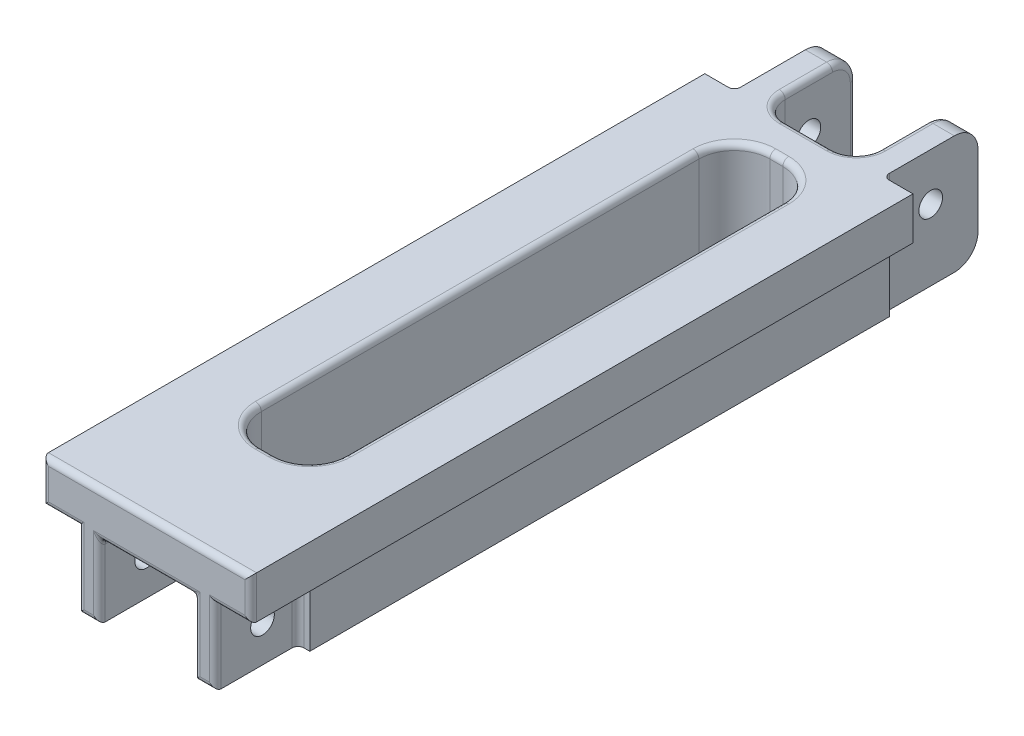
SolidWorks part; units mm, degrees
ref_plane "Front Plane" through (0, 0, 0) normal (0, 0, 1) x (1, 0, 0)
ref_plane "Top Plane" through (0, 0, 0) normal (0, 1, 0) x (1, 0, 0)
ref_plane "Right Plane" through (0, 0, 0) normal (1, 0, 0) x (0, 0, -1)
sketch "Sketch1" plane through (0, 0, 0) normal (0, 0, 1) x (1, 0, 0)
  line L0 (65.5518, -105.918) -> (177.3118, -105.918)
  line L1 (177.3118, -105.918) -> (177.3118, -128.778)
  line L2 (177.3118, -128.778) -> (164.6118, -128.778)
  line L3 (164.6118, -128.778) -> (164.6118, -156.718)
  line L4 (164.6118, -156.718) -> (205.2518, -156.718)
  line L5 (205.2518, -156.718) -> (205.2518, 1.27)
  line L6 (205.2518, 1.27) -> (-323.7269, 1.27)
  line L7 (-323.7269, 1.27) -> (-323.7269, -156.718)
  line L8 (-323.7269, -156.718) -> (-283.0869, -156.718)
  line L9 (-283.0869, -156.718) -> (-283.0869, -128.778)
  line L10 (-283.0869, -128.778) -> (-295.7869, -128.778)
  line L11 (-295.7869, -128.778) -> (-295.7869, -105.918)
  line L12 (-295.7869, -105.918) -> (-184.0269, -105.918)
  line L13 (-184.0269, -105.918) -> (-184.0269, -128.778)
  line L14 (-184.0269, -128.778) -> (-196.7269, -128.778)
  line L15 (-196.7269, -128.778) -> (-196.7269, -156.718)
  line L16 (-196.7269, -156.718) -> (-146.8676, -156.718)
  line L17 (-146.8676, -156.718) -> (-146.8676, -128.778)
  line L18 (-146.8676, -128.778) -> (-159.5676, -128.778)
  line L19 (-159.5676, -128.778) -> (-159.5676, -105.918)
  line L20 (-159.5676, -105.918) -> (41.0924, -105.918)
  line L21 (41.0924, -105.918) -> (41.0924, -128.778)
  line L22 (41.0924, -128.778) -> (28.3924, -128.778)
  line L23 (28.3924, -128.778) -> (28.3924, -156.718)
  line L24 (28.3924, -156.718) -> (78.2518, -156.718)
  line L25 (78.2518, -156.718) -> (78.2518, -128.778)
  line L26 (78.2518, -128.778) -> (65.5518, -128.778)
  line L27 (65.5518, -128.778) -> (65.5518, -105.918)
  line L29 (78.2518, -156.718) -> (164.6118, -156.718) construction
  line L30 (78.2518, -156.718) -> (78.2518, -169.418)
  line L31 (78.2518, -169.418) -> (164.6118, -169.418)
  line L32 (164.6118, -156.718) -> (164.6118, -169.418)
  line L33 (78.2518, -156.718) -> (164.6118, -169.418) construction
  line L34 (78.2518, -169.418) -> (164.6118, -156.718) construction
  line L56 (165.8818, -130.048) -> (165.8818, -155.448)
  line L57 (165.8818, -155.448) -> (203.9818, -155.448)
  line L58 (203.9818, -155.448) -> (203.9818, 0)
  line L59 (203.9818, 0) -> (-322.4569, 0)
  line L60 (-322.4569, 0) -> (-322.4569, -155.448)
  line L61 (-322.4569, -155.448) -> (-284.3569, -155.448)
  line L62 (-284.3569, -155.448) -> (-284.3569, -130.048)
  line L63 (-284.3569, -130.048) -> (-297.0569, -130.048)
  line L64 (-297.0569, -130.048) -> (-297.0569, -104.648)
  line L65 (-297.0569, -104.648) -> (-182.7569, -104.648)
  line L66 (-182.7569, -104.648) -> (-182.7569, -130.048)
  line L67 (-182.7569, -130.048) -> (-195.4569, -130.048)
  line L68 (-195.4569, -130.048) -> (-195.4569, -155.448)
  line L69 (-195.4569, -155.448) -> (-148.1376, -155.448)
  line L70 (-148.1376, -155.448) -> (-148.1376, -130.048)
  line L71 (-148.1376, -130.048) -> (-160.8376, -130.048)
  line L72 (-160.8376, -130.048) -> (-160.8376, -104.648)
  line L73 (-160.8376, -104.648) -> (42.3624, -104.648)
  line L74 (42.3624, -104.648) -> (42.3624, -130.048)
  line L75 (42.3624, -130.048) -> (29.6624, -130.048)
  line L76 (29.6624, -130.048) -> (29.6624, -155.448)
  line L77 (29.6624, -155.448) -> (76.9818, -155.448)
  line L78 (76.9818, -155.448) -> (76.9818, -130.048)
  line L79 (76.9818, -130.048) -> (64.2818, -130.048)
  line L80 (64.2818, -130.048) -> (64.2818, -104.648)
  line L81 (64.2818, -104.648) -> (178.5818, -104.648)
  line L82 (178.5818, -104.648) -> (178.5818, -130.048)
  line L83 (178.5818, -130.048) -> (165.8818, -130.048)
  line L84 (164.6118, -156.718) -> (78.2518, -156.718)
  point P58 (121.4318, -163.068)
  dimension "D1" = 28.3924
  dimension "D2" = 29.6624
  dimension "D3" = 41.0924
  dimension "D4" = 64.2818
  dimension "D5" = 65.5518
  dimension "D6" = 121.4318
  dimension "D7" = 165.8818
  dimension "D8" = 203.9818
  dimension "D9" = 205.2518
  dimension "D10" = 146.8676
  dimension "D11" = 148.1376
  dimension "D12" = 1.27
  dimension "D13" = 104.648
  dimension "D14" = 105.918
  dimension "D15" = 128.778
  dimension "D16" = 130.048
  dimension "D17" = 156.718
extrude "Boss-Extrude1" add sketch "Sketch1" against normal blind 406.4 contours L84 L3 L2 L1 L0 L27 L26 L25 | L32 L84 L30 L31
sketch "Sketch2" plane through (0, 0, -406.4) normal (0, 0, -1) x (-1, 0, 0)
  line L0 (-121.4318, -105.918) -> (-121.4318, -156.718)
  line L3 (-161.4368, -169.418) -> (-161.4368, -105.918)
  line L5 (-146.8318, -169.418) -> (-146.8318, -105.918)
  line L6 (-146.8318, -105.918) -> (-96.0318, -105.918)
  line L7 (-96.0318, -169.418) -> (-96.0318, -105.918)
  line L8 (-146.8318, -156.718) -> (-96.0318, -105.918) construction
  line L9 (-146.8318, -105.918) -> (-96.0318, -156.718) construction
  line L11 (-81.4268, -169.418) -> (-81.4268, -105.918)
  line L12 (-65.5518, -128.778) -> (-65.5518, -105.918) construction
  line L13 (-65.5518, -105.918) -> (-177.3118, -105.918) construction
  line L28 (-78.2518, -169.418) -> (-78.2518, -128.778)
  line L29 (-78.2518, -128.778) -> (-65.5518, -128.778)
  line L30 (-65.5518, -128.778) -> (-65.5518, -105.918)
  line L31 (-65.5518, -105.918) -> (-177.3118, -105.918)
  line L32 (-177.3118, -105.918) -> (-177.3118, -128.778)
  line L33 (-177.3118, -128.778) -> (-164.6118, -128.778)
  line L34 (-164.6118, -128.778) -> (-164.6118, -169.418)
  line L36 (-164.6118, -169.418) -> (-78.2518, -169.418)
  point P6 (-121.4318, -131.318)
  dimension "D1" = 12.7
  dimension "D2" = 15.875
  dimension "D3" = 30.48
  dimension "D4" = 55.88
  dimension "D5" = 95.885
  dimension "D6" = 22.86
  dimension "D7" = 63.5
extrude "Cut-Extrude1" cut sketch "Sketch2" against normal blind 50.8
sketch "Sketch3" plane through (81.4268, 0, 0) normal (-1, 0, 0) x (0, 0, 1)
  line L0 (-406.4, -169.418) -> (-406.4, -105.918) construction
  line L1 (-355.6, -105.918) -> (-406.4, -105.918) construction
  circle A0 centre (-381, -131.318) radius 6.35
  point P6 (0, 0)
  dimension "D1" = 12.7
  dimension "D2" = 25.4
  dimension "D3" = 25.4
extrude "Cut-Extrude2" cut sketch "Sketch3" against normal blind 215.9
ref_plane "Plane1" through (121.4318, 0, 0) normal (1, 0, 0) x (0, 0, -1)
sketch "Sketch4" plane through (121.4318, 0, 0) normal (1, 0, 0) x (0, 0, -1)
  line L3 (0, -105.918) -> (0, -128.778) construction
  line L4 (355.6, -105.918) -> (0, -105.918) construction
  line L6 (44.45, -149.098) -> (44.45, -168.148)
  line L7 (44.45, -168.148) -> (25.4, -168.148)
  line L9 (25.4, -130.048) -> (-7.9413, -130.048)
  line L10 (25.4, -130.048) -> (25.4, -168.148)
  line L11 (25.4, -168.148) -> (-7.9413, -168.148)
  line L12 (-7.9413, -130.048) -> (-7.9413, -168.148)
  line L13 (25.4, -130.048) -> (-7.9413, -168.148) construction
  line L14 (25.4, -168.148) -> (-7.9413, -130.048) construction
  line L15 (-7.9413, -168.148) -> (44.45, -168.148)
  line L16 (-7.9413, -168.148) -> (-7.9413, -197.6525)
  line L17 (-7.9413, -197.6525) -> (44.45, -197.6525)
  line L18 (44.45, -168.148) -> (44.45, -197.6525)
  line L19 (-7.9413, -168.148) -> (44.45, -197.6525) construction
  line L20 (-7.9413, -197.6525) -> (44.45, -168.148) construction
  circle A0 centre (25.4, -149.098) radius 6.35
  circle A3 centre (25.4, -149.098) radius 19.05
  point P13 (8.7294, -149.098)
  point P16 (18.2544, -182.9002)
  dimension "D1" = 12.7
  dimension "D2" = 38.1
  dimension "D3" = 25.4
  dimension "D4" = 43.18
extrude "Cut-Extrude3" cut sketch "Sketch4" against normal mid plane 50.8 contours A3 L7 L6 | A3 L10 A0 | L10 A3 A0 | A3 L9 L12 L11 | L10 A0 | L10 A0 | L18 L7 L11 L16 L17
sketch "Sketch5" plane through (0, -169.418, -39.0066) normal (0, 1, 0) x (1, 0, 0)
  line L1 (158.2618, -39.0066) -> (84.6018, -39.0066)
  line L2 (158.2618, -39.0066) -> (158.2618, 79.3855)
  line L3 (164.6118, 5.4434) -> (78.2518, 5.4434)
  line L4 (84.6018, -39.0066) -> (84.6018, 79.3855)
  line L5 (158.2618, -39.0066) -> (84.6018, 79.3855) construction
  line L6 (158.2618, 79.3855) -> (84.6018, -39.0066) construction
  line L10 (96.0318, 5.4434) -> (146.8318, 5.4434)
  line L18 (571.0118, 451.8725) -> (-648.1882, 451.8725)
  line L19 (571.0118, 308.1896) -> (571.0118, 451.8725)
  line L20 (-648.1882, 308.1896) -> (571.0118, 308.1896)
  line L21 (-648.1882, 451.8725) -> (-648.1882, 308.1896)
  line L51 (96.0318, -39.0066) -> (96.0318, 5.4434)
  line L52 (78.2518, -39.0066) -> (96.0318, -39.0066)
  line L53 (78.2518, 316.5934) -> (78.2518, -39.0066)
  line L54 (81.4268, 316.5934) -> (78.2518, 316.5934)
  line L55 (81.4268, 367.3934) -> (81.4268, 316.5934)
  line L56 (96.0318, 367.3934) -> (81.4268, 367.3934)
  line L57 (96.0318, 316.5934) -> (96.0318, 367.3934)
  line L58 (146.8318, 316.5934) -> (96.0318, 316.5934)
  line L59 (146.8318, 367.3934) -> (146.8318, 316.5934)
  line L60 (161.4368, 367.3934) -> (146.8318, 367.3934)
  line L61 (161.4368, 316.5934) -> (161.4368, 367.3934)
  line L62 (164.6118, 316.5934) -> (161.4368, 316.5934)
  line L63 (164.6118, -39.0066) -> (164.6118, 316.5934)
  line L64 (146.8318, -39.0066) -> (164.6118, -39.0066)
  line L65 (146.8318, 5.4434) -> (146.8318, -39.0066)
  line L66 (96.0318, 5.4434) -> (146.8318, 5.4434)
  point P4 (121.4318, 20.1894)
  dimension "D1" = 78.2518
  dimension "D2" = 81.4268
  dimension "D3" = 84.6018
  dimension "D4" = 96.0318
  dimension "D5" = 121.4318
  dimension "D6" = 146.8318
  dimension "D7" = 571.0118
  dimension "D8" = 648.1882
  dimension "D9" = 44.45
  dimension "D10" = 59.196
  dimension "D11" = 347.1962
  dimension "D12" = 355.6
  dimension "D13" = 490.8791
extrude "Cut-Extrude4" cut sketch "Sketch5" along normal up to surface and the other way through all
sketch "Sketch6" plane through (84.6018, 0, 0) normal (-1, 0, 0) x (0, 0, 1)
  line L4 (0, -169.418) -> (0, -130.048)
  line L5 (0, -130.048) -> (-25.4, -130.048)
  line L6 (-44.45, -149.098) -> (-44.45, -169.418)
  line L7 (-44.45, -169.418) -> (0, -169.418)
  line L8 (0, -169.418) -> (0, -130.048)
  line L9 (0, -130.048) -> (-25.4, -130.048)
  line L10 (-44.45, -149.098) -> (-44.45, -169.418)
  line L13 (-44.45, -169.418) -> (0, -169.418)
  circle A0 centre (-25.4, -149.098) radius 6.35
  arc A1 (-25.4, -130.048) -> (-44.45, -149.098) centre (-25.4, -149.098) ccw
  arc A2 (-25.4, -130.048) -> (-44.45, -149.098) centre (-25.4, -149.098) ccw
  dimension "D2" = 12.7
  dimension "D1" = 0
extrude "Cut-Extrude5" cut sketch "Sketch6" against normal through all contours A0
fillet "Fillet1" radius 12.7 6 edges at (88.7293, -105.918, -406.4) (154.1343, -105.918, -406.4) (88.7293, -169.418, -406.4) (154.1343, -169.418, -406.4) (96.0318, -137.668, -355.6) (146.8318, -137.668, -355.6)
sketch "Sketch7" plane through (0, -169.418, 0) normal (0, -1, 0) x (1, 0, 0)
  line L0 (81.4268, -44.45) -> (81.4268, -355.6)
  line L1 (145.5618, -355.6) -> (145.5618, -44.45)
  line L2 (100.4768, -44.45) -> (100.4768, -355.6)
  line L3 (158.2618, -336.55) -> (89.371, -336.55)
  line L4 (152.8122, -63.5) -> (92.005, -63.5)
  line L20 (146.8318, -368.3) -> (146.8318, -393.7)
  line L21 (146.8318, -393.7) -> (161.4368, -393.7)
  line L22 (161.4368, -393.7) -> (161.4368, -355.6)
  line L23 (161.4368, -355.6) -> (164.6118, -355.6)
  line L24 (164.6118, -355.6) -> (164.6118, -44.45)
  line L25 (164.6118, -44.45) -> (158.2618, -44.45)
  line L26 (158.2618, -44.45) -> (158.2618, 0)
  line L27 (158.2618, 0) -> (146.8318, 0)
  line L28 (146.8318, 0) -> (146.8318, -44.45)
  line L29 (146.8318, -44.45) -> (96.0318, -44.45)
  line L30 (96.0318, -44.45) -> (96.0318, 0)
  line L31 (96.0318, 0) -> (84.6018, 0)
  line L32 (84.6018, 0) -> (84.6018, -44.45)
  line L33 (84.6018, -44.45) -> (78.2518, -44.45)
  line L34 (78.2518, -44.45) -> (78.2518, -355.6)
  line L35 (78.2518, -355.6) -> (81.4268, -355.6)
  line L36 (81.4268, -355.6) -> (81.4268, -393.7)
  line L37 (81.4268, -393.7) -> (96.0318, -393.7)
  line L38 (96.0318, -393.7) -> (96.0318, -368.3)
  line L39 (108.7318, -355.6) -> (134.1318, -355.6)
  line L40 (146.8318, -368.3) -> (146.8318, -393.7)
  line L41 (146.8318, -393.7) -> (161.4368, -393.7)
  line L42 (161.4368, -393.7) -> (161.4368, -355.6)
  line L43 (161.4368, -355.6) -> (164.6118, -355.6)
  line L44 (164.6118, -355.6) -> (164.6118, -44.45)
  line L45 (164.6118, -44.45) -> (158.2618, -44.45)
  line L46 (158.2618, -44.45) -> (158.2618, 0)
  line L47 (158.2618, 0) -> (146.8318, 0)
  line L48 (146.8318, 0) -> (146.8318, -44.45)
  line L49 (146.8318, -44.45) -> (96.0318, -44.45)
  line L50 (96.0318, -44.45) -> (96.0318, 0)
  line L51 (96.0318, 0) -> (84.6018, 0)
  line L52 (84.6018, 0) -> (84.6018, -44.45)
  line L53 (84.6018, -44.45) -> (78.2518, -44.45)
  line L54 (78.2518, -44.45) -> (78.2518, -355.6)
  line L55 (78.2518, -355.6) -> (81.4268, -355.6)
  line L56 (81.4268, -355.6) -> (81.4268, -393.7)
  line L57 (81.4268, -393.7) -> (96.0318, -393.7)
  line L58 (96.0318, -393.7) -> (96.0318, -368.3)
  line L59 (108.7318, -355.6) -> (134.1318, -355.6)
  arc A2 (108.7318, -355.6) -> (96.0318, -368.3) centre (108.7318, -368.3) ccw
  arc A3 (146.8318, -368.3) -> (134.1318, -355.6) centre (134.1318, -368.3) ccw
  arc A4 (108.7318, -355.6) -> (96.0318, -368.3) centre (108.7318, -368.3) ccw
  arc A5 (146.8318, -368.3) -> (134.1318, -355.6) centre (134.1318, -368.3) ccw
  dimension "D4" = 19.05
  dimension "D5" = 19.05
  dimension "D1" = 0
  dimension "D2" = 3.175
  dimension "D3" = 19.05
extrude "Cut-Extrude6" cut sketch "Sketch7" against normal blind 100.076 contours L1 L4 L2 L3
fillet "Fillet2" radius 19.05 4 edges at (145.5618, -137.668, -336.55) (100.4768, -137.668, -336.55) (100.4768, -137.668, -63.5) (145.5618, -137.668, -63.5)
fillet "Fillet3" radius 3.175 16 edges at (123.0193, -105.918, -63.5) (139.9822, -105.918, -69.0796) (145.5618, -105.918, -200.025) (139.9822, -105.918, -330.9704) (123.0193, -105.918, -336.55) (106.0564, -105.918, -330.9704) (100.4768, -105.918, -200.025) (123.0193, -169.418, -336.55) (139.9822, -169.418, -330.9704) (145.5618, -169.418, -200.025) (139.9822, -169.418, -69.0796) (123.0193, -169.418, -63.5) (106.0564, -169.418, -69.0796) (100.4768, -169.418, -200.025) (106.0564, -105.918, -69.0796) (106.0564, -169.418, -330.9704)
fillet "Fillet4" radius 3.175 26 edges at (75.0768, -128.778, 0) (152.5468, -169.418, 0) (146.8318, -149.733, 0) (121.4318, -130.048, 0) (96.0318, -149.733, 0) (65.5518, -117.348, 0) (121.4318, -105.918, 0) (177.3118, -117.348, 0) (167.7868, -128.778, 0) (90.3168, -169.418, 0) (158.2618, -149.098, 0) (84.6018, -149.098, 0) (146.8318, -137.668, -406.4) (146.8318, -105.918, -381) (146.8318, -165.6983, -402.6803) (146.8318, -109.6377, -402.6803) (121.4318, -169.418, -355.6) (121.4318, -105.918, -355.6) (96.0318, -137.668, -406.4) (96.0318, -105.918, -381) (96.0318, -165.6983, -402.6803) (96.0318, -109.6377, -402.6803) (143.112, -105.918, -359.3197) (143.112, -169.418, -359.3197) (99.7515, -105.918, -359.3197) (99.7515, -169.418, -359.3197)
fillet "Fillet5" radius 3.175 12 edges at (146.8318, -159.258, -44.45) (96.0318, -159.258, -44.45) (95.1018, -129.1181, -0.9299) (96.0318, -130.048, -14.2875) (147.7617, -129.1181, -0.9299) (146.8318, -130.048, -14.2875) (146.8318, -135.6276, -38.8704) (96.0318, -135.6276, -38.8704) (84.6018, -149.098, -44.45) (158.2618, -149.098, -44.45) (81.4268, -137.668, -355.6) (161.4368, -137.668, -355.6)
fillet "Fillet6" radius 3.175 2 edges at (78.2518, -128.778, -200.025) (164.6118, -128.778, -200.025)
